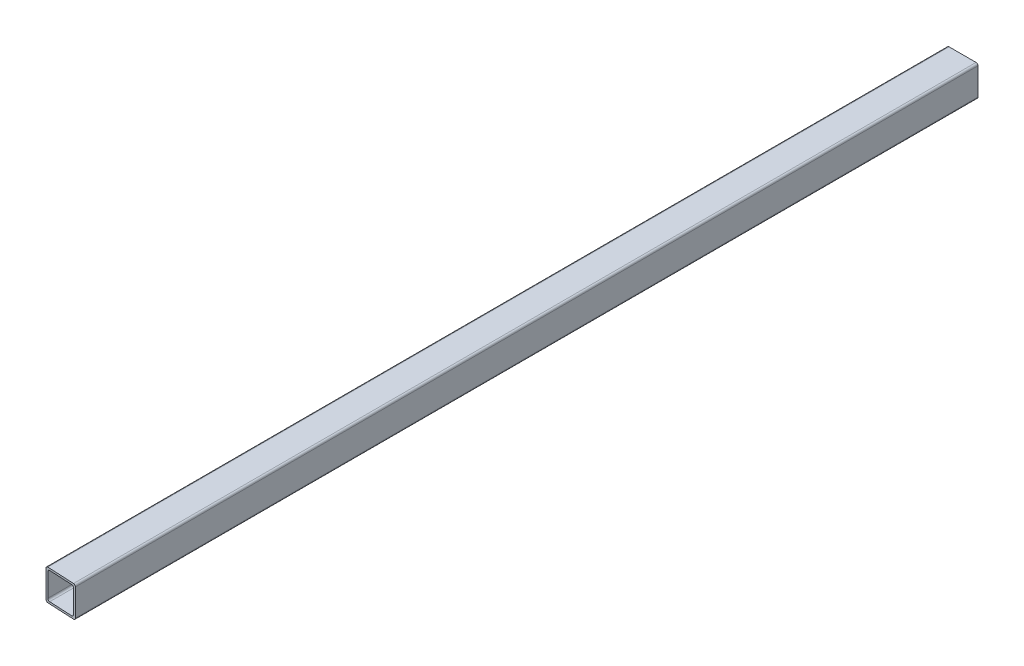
SolidWorks part; units mm, degrees
ref_plane "Plan de face" through (0, 0, 0) normal (0, 0, 1) x (1, 0, 0)
ref_plane "Plan de dessus" through (0, 0, 0) normal (0, 1, 0) x (1, 0, 0)
ref_plane "Plan de droite" through (0, 0, 0) normal (1, 0, 0) x (0, 0, -1)
sketch "Esquisse1" plane through (0, 0, 0) normal (0, 0, 1) x (1, 0, 0)
  line L0 (-70, 0) -> (70, 0) construction
  line L1 (-35, 40) -> (35, 40)
  line L2 (-40, 35) -> (-40, -35)
  line L3 (-35, -40) -> (35, -40)
  line L4 (40, 35) -> (40, -35)
  line L5 (-70, 70) -> (-70, -70) construction
  line L6 (70, -70) -> (70, 70) construction
  line L7 (0, 70) -> (0, -70) construction
  line L8 (70, 70) -> (-70, 70) construction
  line L9 (-70, -70) -> (70, -70) construction
  line L10 (-30, 35) -> (30, 35)
  line L11 (35, 30) -> (35, -30)
  line L12 (-30, -35) -> (30, -35)
  line L13 (-35, 30) -> (-35, -30)
  line L14 (-35, 35) -> (35, 35) construction
  line L15 (35, 35) -> (35, -35) construction
  line L16 (-35, -35) -> (35, -35) construction
  line L17 (-35, 35) -> (-35, -35) construction
  arc A0 (35, 40) -> (40, 35) centre (35, 35) cw
  arc A1 (40, -35) -> (35, -40) centre (35, -35) cw
  arc A2 (-35, -40) -> (-40, -35) centre (-35, -35) cw
  arc A3 (-40, 35) -> (-35, 40) centre (-35, 35) cw
  arc A4 (35, -30) -> (30, -35) centre (30, -30) cw
  arc A5 (-30, -35) -> (-35, -30) centre (-30, -30) cw
  arc A6 (-35, 30) -> (-30, 35) centre (-30, 30) cw
  arc A8 (30, 35) -> (35, 30) centre (30, 30) cw
  arc A9 (35, 35) -> (35, 35) centre (35, 35) cw construction
  arc A10 (35, -35) -> (35, -35) centre (35, -35) cw construction
  arc A11 (-35, -35) -> (-35, -35) centre (-35, -35) cw construction
  arc A12 (-35, 35) -> (-35, 35) centre (-35, 35) cw construction
  point P18 (40, 40)
  point P23 (-40, -40)
  point P26 (-40, 40)
  dimension "D5" = 5
  dimension "D7" = 5
  dimension "D1" = 80
  dimension "D2" = 80
  dimension "D3" = 40
  dimension "D4" = 40
  dimension "D6" = 5
extrude "Boss.-Extru.2" add sketch "Esquisse1" along normal up to surface (2335.7494 mm away)
